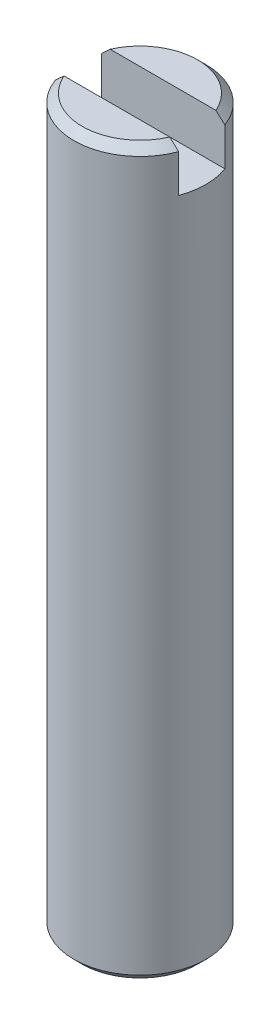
SolidWorks part; units mm, degrees
ref_plane "Face" through (0, 0, 0) normal (0, 0, 1) x (1, 0, 0)
ref_plane "Dessus" through (0, 0, 0) normal (0, 1, 0) x (1, 0, 0)
ref_plane "Droite" through (0, 0, 0) normal (1, 0, 0) x (0, 0, -1)
sketch "Esquisse1" plane through (0, 0, 0) normal (0, 1, 0) x (1, 0, 0)
  circle A0 centre (0, 0) radius 2
  dimension "D1" = 4
extrude "Base-Extrusion" add sketch "Esquisse1" against normal blind 22
chamfer "Chanfrein1" distance 0.25 angle 45 2 edges at (0, 0, 2) (0, -22, 2)
sketch "Esquisse2" plane through (0, 0, 0) normal (0, 1, 0) x (-1, 0, 0)
  line L0 (-2.3189, 0) -> (2.4823, 0) construction
  line L1 (-1.8735, -0.7) -> (1.8735, -0.7)
  line L2 (-1.8735, 0.7) -> (1.8735, 0.7)
  circle A0 centre (0, 0) radius 2 construction
  arc A1 (1.8735, -0.7) -> (1.8735, 0.7) centre (0, 0) ccw
  arc A2 (-1.8735, 0.7) -> (-1.8735, -0.7) centre (0, 0) ccw
  dimension "D1" = 1.4
extrude "Enlèv. mat.-Extru.1" cut sketch "Esquisse2" against normal blind 1.4
